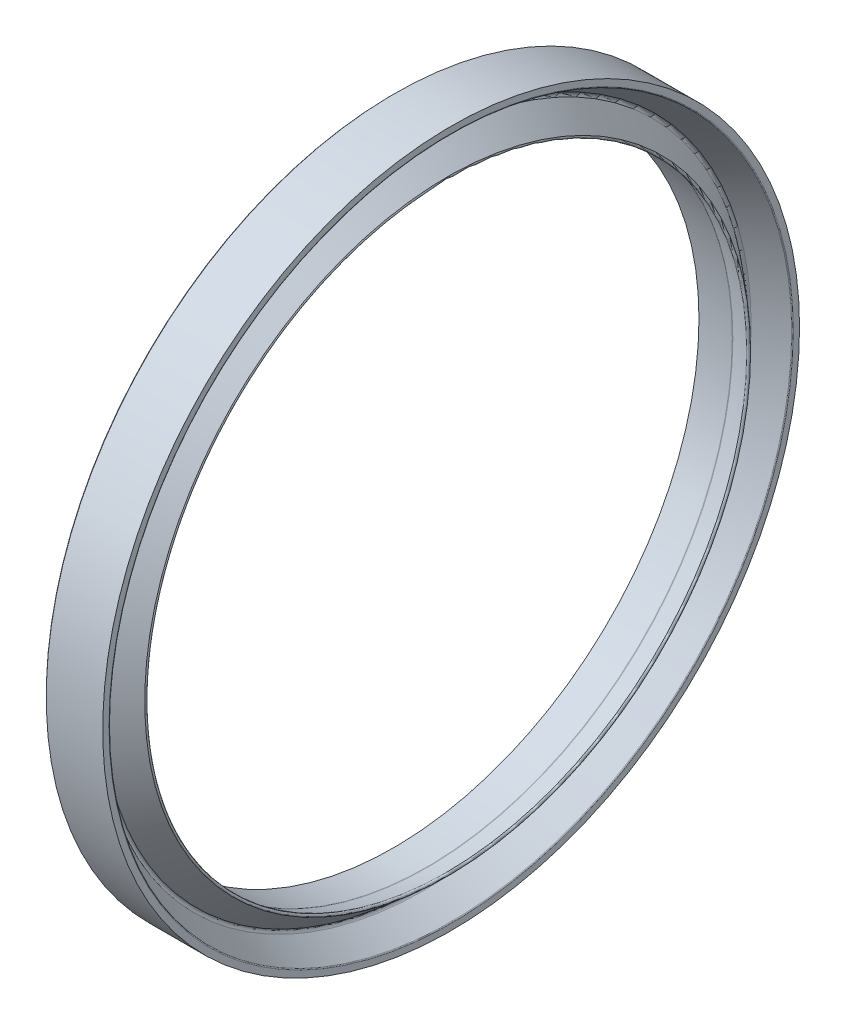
SolidWorks part; units mm, degrees
ref_plane "Plan1" through (0, 0, 0) normal (0, 0, 1) x (1, 0, 0)
ref_plane "Plan2" through (0, 0, 0) normal (0, 1, 0) x (1, 0, 0)
ref_plane "Plan3" through (0, 0, 0) normal (1, 0, 0) x (0, 0, -1)
sketch "Esquisse1" plane through (0, 0, 0) normal (0, 0, 1) x (-1, 0, 0)
  line L0 (9.4, 58) -> (9.6, 57.8)
  line L3 (0, 58) -> (9.4, 58)
  line L4 (0, 58) -> (0, 56.9629)
  line L5 (0.1, 56.7897) -> (4.3789, 54.3192)
  line L6 (9.6, 57.8) -> (9.6, 50.8574)
  line L7 (4.436, 53.6664) -> (0.577, 50.4283)
  line L8 (0, 0) -> (0, 58) construction
  line L9 (-2.434, 0) -> (3.3798, 0) construction
  line L10 (9.6, 50.8574) -> (4.0527, 50.8574)
  line L11 (3.9491, 50.8438) -> (0.8, 50)
  arc A0 (4.0527, 50.8574) -> (3.9491, 50.8438) centre (4.0527, 50.4574) ccw
  arc A1 (4.3789, 54.3192) -> (4.436, 53.6664) centre (4.1789, 53.9728) cw
  arc A2 (0.1, 56.7897) -> (0, 56.9629) centre (0.2, 56.9629) cw
  arc A4 (0.577, 50.4283) -> (0.8, 50) centre (0.736, 50.2389) ccw
  point P10 (4, 50.8574)
  point P13 (4.8736, 54.0336)
  point P20 (3.6812, 51.685)
  point P24 (0, 56.8474)
  dimension "D5" = 70
  dimension "D6" = 25
  dimension "D10" = 0.4
  dimension "D11" = 0.2
  dimension "D8" = 1.685
  dimension "D3" = 0.8
  dimension "D1" = 45
  dimension "Diamètre extérieur" = 58
  dimension "D2" = 0.2
  dimension "Epaisseur" = 9.6
  dimension "D4" = 120
  dimension "D7" = 4
  dimension "D9" = 3.6812
  dimension "Diamètre nominal" = 50
revolve "Base-Révolution" add sketch "Esquisse1" angle 360 about L9
scale "Echelle1" scale about centroid uniform scaling yes scale factor 0.5
